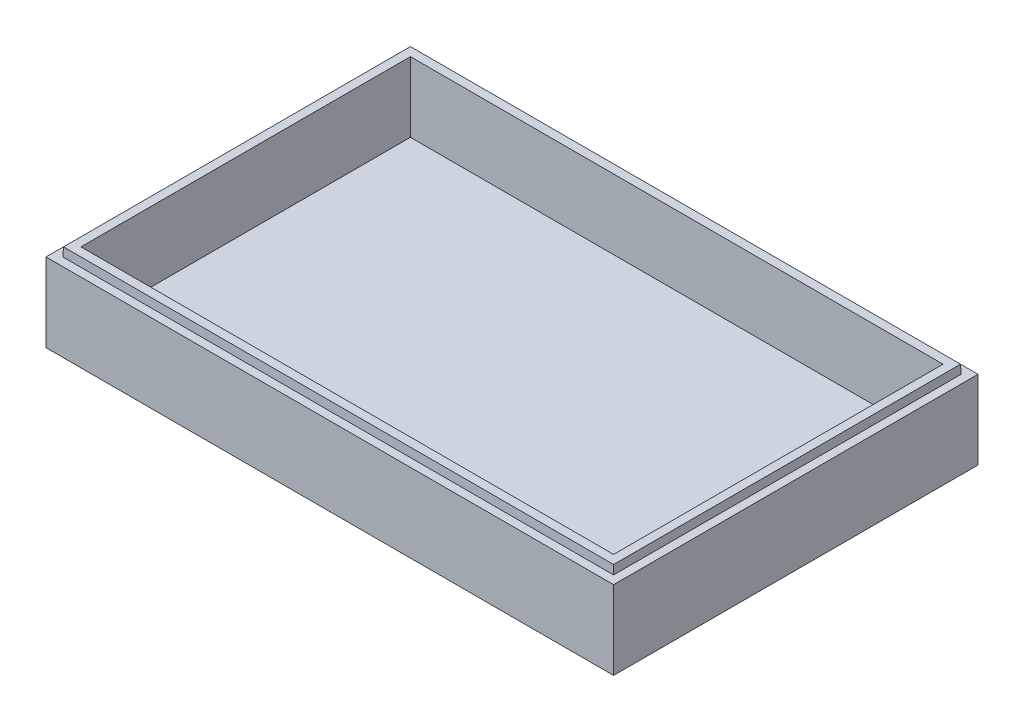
SolidWorks part; units mm, degrees
ref_plane "Front Plane" through (0, 0, 0) normal (0, 0, 1) x (1, 0, 0)
ref_plane "Top Plane" through (0, 0, 0) normal (0, 1, 0) x (1, 0, 0)
ref_plane "Right Plane" through (0, 0, 0) normal (1, 0, 0) x (0, 0, -1)
sketch "Sketch1" plane through (0, 0, 0) normal (0, 1, 0) x (1, 0, 0)
  line L1 (0, 0) -> (129.9664, 0)
  line L2 (0, 0) -> (0, -83.4381)
  line L3 (0, -83.4381) -> (129.9664, -83.4381)
  line L4 (129.9664, 0) -> (129.9664, -83.4381)
extrude "Boss-Extrude1" add sketch "Sketch1" along normal blind 20
shell "Shell1" thickness 4
other "Groove1" parameters "GrooveHeight"=2, "GrooveWidth"=2, "GrooveDraftAngle"=2, "D4"=0, "D5"=0, "D6"=2, "D7"=1, "D8"=2, "D9"=0
